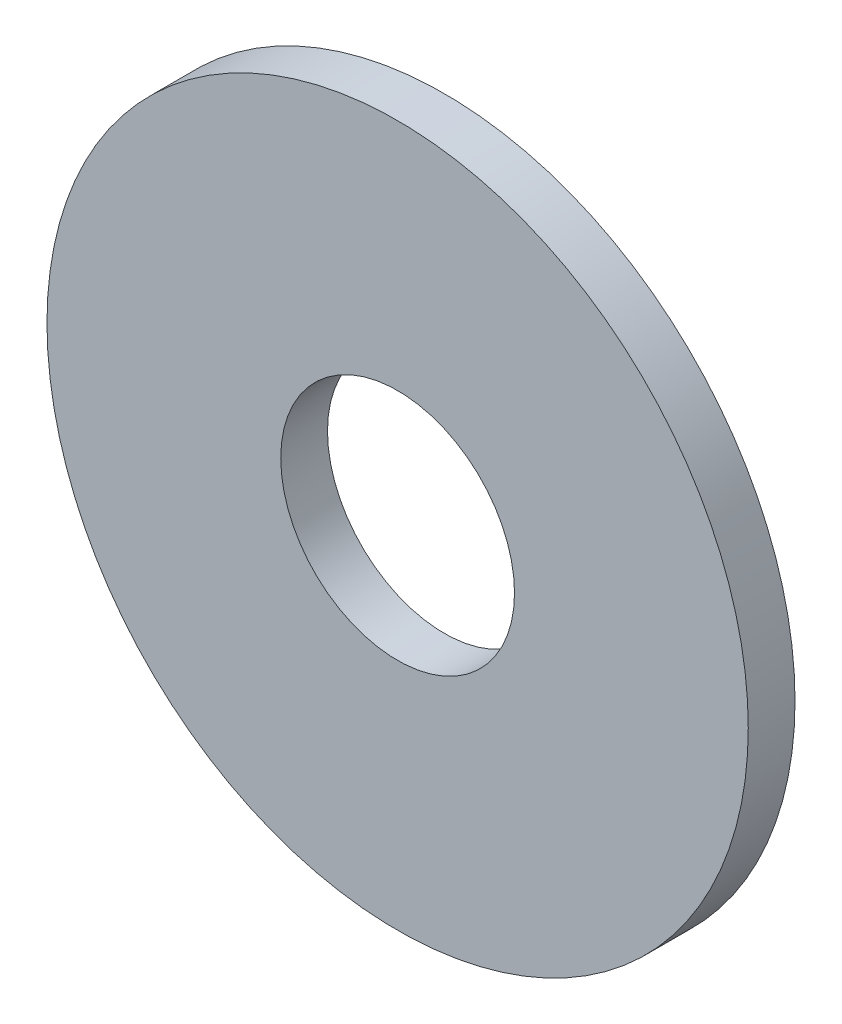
SolidWorks part; units mm, degrees
ref_plane "Alzado" through (0, 0, 0) normal (0, 0, 1) x (1, 0, 0)
ref_plane "Planta" through (0, 0, 0) normal (0, 1, 0) x (1, 0, 0)
ref_plane "Vista lateral" through (0, 0, 0) normal (1, 0, 0) x (0, 0, -1)
sketch "Croquis1" plane through (0, 0, 0) normal (0, 0, 1) x (1, 0, 0)
  circle A0 centre (0, 0) radius 15
  circle A1 centre (0, 0) radius 5
  dimension "D1" = 10
  dimension "D2" = 10
extrude "Saliente-Extruir1" add sketch "Croquis1" along normal blind 2
